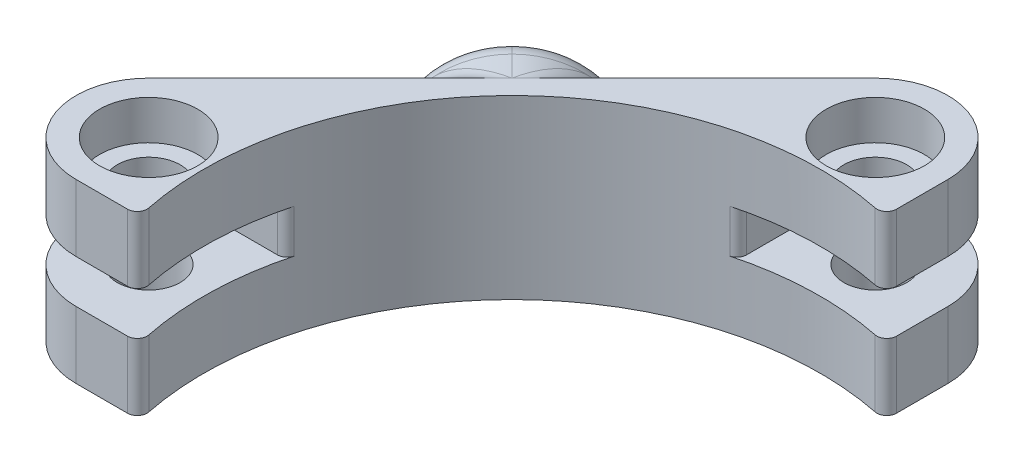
SolidWorks part; units mm, degrees
ref_plane "Front Plane" through (0, 0, 0) normal (0, 0, 1) x (1, 0, 0)
ref_plane "Top Plane" through (0, 0, 0) normal (0, 1, 0) x (1, 0, 0)
ref_plane "Right Plane" through (0, 0, 0) normal (1, 0, 0) x (0, 0, -1)
sketch "Sketch1" plane through (0, 0, 0) normal (0, 1, 0) x (1, 0, 0)
  line L0 (-18.5, 0) -> (-26.9814, 8.4814) construction
  line L1 (-3.7, 18.5) -> (3.7, 18.5)
  line L2 (-3.7, 18.5) -> (-3.7, -18.5)
  line L3 (-3.7, -18.5) -> (3.7, -18.5)
  line L4 (3.7, 18.5) -> (3.7, -18.5)
  line L5 (-3.7, 18.5) -> (3.7, -18.5) construction
  line L6 (-3.7, -18.5) -> (3.7, 18.5) construction
  line L7 (-18.5, 3.7) -> (18.5, 3.7)
  line L8 (-18.5, 3.7) -> (-18.5, -3.7)
  line L9 (-18.5, -3.7) -> (18.5, -3.7)
  line L10 (18.5, 3.7) -> (18.5, -3.7)
  line L11 (-18.5, 3.7) -> (18.5, -3.7) construction
  line L12 (-18.5, -3.7) -> (18.5, 3.7) construction
  line L13 (0, 18.5) -> (-2.6163, 21.1163) construction
  line L14 (-21.1163, 2.6163) -> (-2.6163, 21.1163)
  line L15 (-11.8663, 11.8663) -> (-13.9876, 13.9876) construction
  line L16 (-17.1696, 10.8056) -> (-10.8056, 17.1696)
  line L17 (-10.8056, 17.1696) -> (-8.6843, 15.0483)
  line L18 (-17.1696, 10.8056) -> (-15.0483, 8.6843)
  circle A0 centre (0, 0) radius 15.7
  circle A2 centre (-18.5, 0) radius 3.7
  circle A3 centre (0, 18.5) radius 3.7
  dimension "D1" = 31.4
  dimension "D2" = 7.4
  dimension "D3" = 7.4
  dimension "D4" = 37
  dimension "D5" = 37
  dimension "D6" = 3
  dimension "D7" = 4.5
extrude "Boss-Extrude1" add sketch "Sketch1" along normal blind 9 contours A3 L14 A2 L7 A0 L2 | L16 L18 L14 L17 | L8 A2 | L8 A2 A0 | A2 A0 L7 | A2 L9 A0 | A0 A3 L1 | L1 A3 | A3 A0 L4 | A3 L2 A0
fillet "Fillet1" radius 4.5 4 edges at (-9.745, 0, -16.1089) (-9.745, 9, -16.1089) (-16.1089, 0, -9.745) (-16.1089, 9, -9.745)
sketch "Sketch2" plane through (-13.9876, 0, -13.9876) normal (-0.7071, 0, -0.7071) x (-0.7071, 0, 0.7071)
  circle A0 centre (0, 4.5) radius 3.1
  dimension "D1" = 6.2
extrude "Cut-Extrude1" cut sketch "Sketch2" against normal blind 3.1
sketch "Sketch3" plane through (-11.7956, 0, -11.7956) normal (-0.7071, 0, -0.7071) x (-0.7071, 0, 0.7071)
  circle A0 centre (0, 4.5) radius 2.75
  dimension "D1" = 5.5
extrude "Cut-Extrude2" cut sketch "Sketch3" against normal blind 0.5
ref_plane "Plane1" through (0, 5.6, 0) normal (0, 1, 0) x (1, 0, 0)
sketch "Sketch4" plane through (0, 5.6, 0) normal (0, 1, 0) x (1, 0, 0)
  line L1 (-3.7, -18.5) -> (3.7, -18.5)
  line L2 (-3.7, -18.5) -> (-3.7, 18.5)
  line L3 (-3.7, 18.5) -> (3.7, 18.5)
  line L4 (3.7, -18.5) -> (3.7, 18.5)
  line L5 (-3.7, -18.5) -> (3.7, 18.5) construction
  line L6 (-3.7, 18.5) -> (3.7, -18.5) construction
  line L7 (18.5, -3.7) -> (-18.5, -3.7)
  line L8 (18.5, -3.7) -> (18.5, 3.7)
  line L9 (18.5, 3.7) -> (-18.5, 3.7)
  line L10 (-18.5, -3.7) -> (-18.5, 3.7)
  line L11 (18.5, -3.7) -> (-18.5, 3.7) construction
  line L12 (18.5, 3.7) -> (-18.5, -3.7) construction
  circle A0 centre (-18.5, 0) radius 3.7
  circle A1 centre (0, 18.5) radius 3.7
  point P6 (0, 0)
  point P13 (0, 0)
extrude "Cut-Extrude3" cut sketch "Sketch4" against normal blind 2.2 contours L3 A1 | L3 A1 | A1 L2 L9 L4 | L10 A0 | L10 A0 | A0 L7 L2 L9
sketch "Sketch5" plane through (0, 9, 0) normal (0, 1, 0) x (1, 0, 0)
  circle A0 centre (-18.5, 0) radius 2.5
  circle A1 centre (0, 18.5) radius 2.5
  dimension "D1" = 5
  dimension "D2" = 5
extrude "Cut-Extrude4" cut sketch "Sketch5" against normal blind 2
sketch "Sketch6" plane through (0, 0, 0) normal (0, -1, 0) x (-1, 0, 0)
  circle A0 centre (18.5, 0) radius 1.6
  circle A1 centre (0, 18.5) radius 1.6
  dimension "D1" = 3.2
  dimension "D2" = 3.2
extrude "Cut-Extrude5" cut sketch "Sketch6" against normal blind 9
fillet "Fillet2" radius 0.5 4 edges at (-2.6163, 4.5, -21.1163) (-21.1163, 4.5, -2.6163) (-3.7, 4.5, -15.2578) (-15.2578, 4.5, -3.7)
fillet "Fillet3" radius 0.5 4 edges at (3.7, 7.3, -15.2578) (3.7, 1.7, -15.2578) (-15.2578, 7.3, 3.7) (-15.2578, 1.7, 3.7)
fillet "Fillet4" radius 1.5 4 edges at (-9.6163, 1.318, -14.1163) (-14.1163, 1.318, -9.6163) (-14.1163, 7.682, -9.6163) (-9.6163, 7.682, -14.1163)
fillet "Fillet5" radius 1.5 4 edges at (-16.2376, 1.318, -11.7376) (-11.7376, 1.318, -16.2376) (-11.7376, 7.682, -16.2376) (-16.2376, 7.682, -11.7376)
